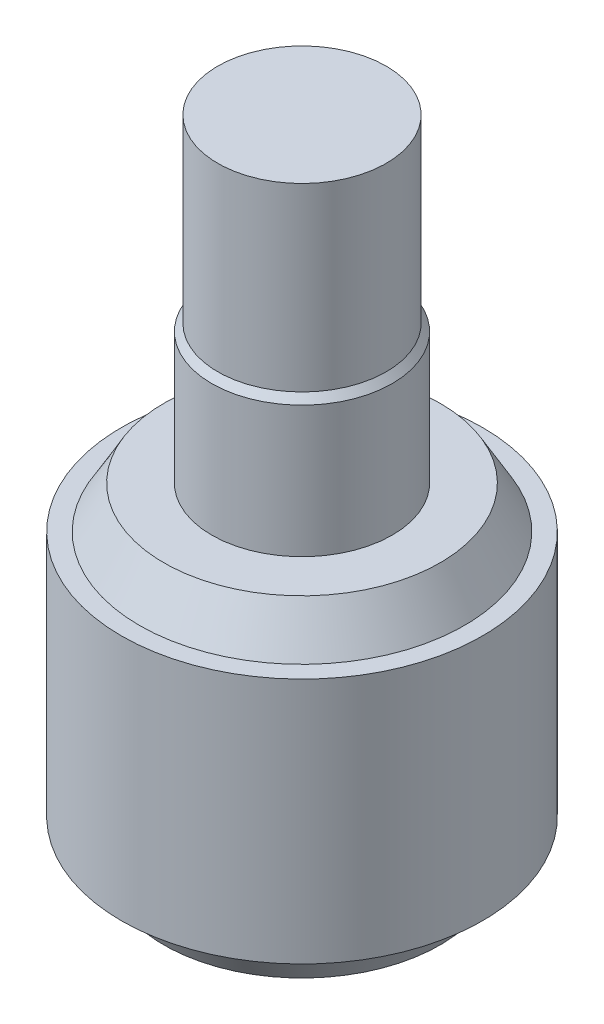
SolidWorks part; units mm, degrees
ref_plane "Front" through (0, 0, 0) normal (0, 0, 1) x (1, 0, 0)
ref_plane "Top" through (0, 0, 0) normal (0, 1, 0) x (1, 0, 0)
ref_plane "Right" through (0, 0, 0) normal (1, 0, 0) x (0, 0, -1)
sketch "Sketch1" plane through (0, 0, 0) normal (0, 0, 1) x (1, 0, 0)
  line L0 (0, 0) -> (0, 30.3621) construction
  line L1 (0, 0) -> (2.2959, 0)
  line L2 (2.2959, 0) -> (2.7, 0.7)
  line L3 (2.7, 0.7) -> (3, 0.7)
  line L4 (3, 0.7) -> (3, 4.8)
  line L5 (3, 4.8) -> (2.7, 4.8)
  line L6 (2.7, 4.8) -> (2.2959, 5.5)
  line L7 (2.2959, 5.5) -> (1.5, 5.5)
  line L8 (1.5, 5.5) -> (1.5, 7.6808)
  line L9 (1.5, 7.6808) -> (1.4, 7.8)
  line L10 (1.4, 7.8) -> (1.4, 10.8)
  line L11 (1.4, 10.8) -> (0, 10.8)
  line L12 (0, 10.8) -> (0, 0)
  dimension "D1" = 120
  dimension "D2" = 120
  dimension "D3" = 140
  dimension "D4" = 0.7
  dimension "D5" = 0.7
  dimension "D6" = 6
  dimension "D7" = 5.5
  dimension "D8" = 6
  dimension "D9" = 3
  dimension "D10" = 3
  dimension "D11" = 0.1
  dimension "D12" = 0.3
revolve "Revolve1" add sketch "Sketch1" angle 360 about L0
